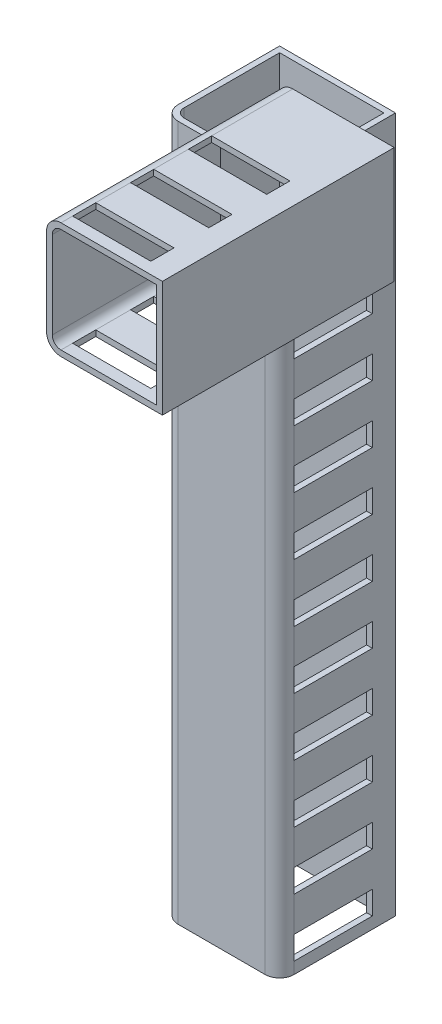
SolidWorks part; units mm, degrees
ref_plane "Front Plane" through (0, 0, 0) normal (0, 0, 1) x (1, 0, 0)
ref_plane "Top Plane" through (0, 0, 0) normal (0, 1, 0) x (1, 0, 0)
ref_plane "Right Plane" through (0, 0, 0) normal (1, 0, 0) x (0, 0, -1)
sketch "Sketch1" plane through (0, 0, 0) normal (0, 0, 1) x (1, 0, 0)
  line L1 (-70.7206, 279.4357) -> (-19.9206, 279.4357)
  line L2 (-70.7206, 279.4357) -> (-70.7206, -25.3643)
  line L3 (-70.7206, -25.3643) -> (-19.9206, -25.3643)
  line L4 (-19.9206, 279.4357) -> (-19.9206, -25.3643)
  dimension "D1" = 304.8
  dimension "D2" = 50.8
  dimension "D3" = 19.9206
  dimension "D4" = 279.4357
extrude "Boss-Extrude1" add sketch "Sketch1" along normal blind 50.8
ref_plane "Plane1" through (-0.1086, 0, 0) normal (1, 0, 0) x (0, 0, -1)
sketch "Sketch2" plane through (-0.1086, 0, 0) normal (-1, 0, 0) x (0, 0, 1)
  line L0 (3.0697, 113.4364) -> (3.0697, 138.8364) construction
  line L1 (121.969, 286.4007) -> (20.369, 286.4007)
  line L2 (121.969, 286.4007) -> (121.969, 235.6007)
  line L3 (121.969, 235.6007) -> (20.369, 235.6007)
  line L4 (20.369, 286.4007) -> (20.369, 235.6007)
  dimension "D1" = 50.8
  dimension "D2" = 101.6
  dimension "D3" = 17.2993
  dimension "D4" = 235.6007
extrude "Boss-Extrude2" add sketch "Sketch2" along normal blind 50.8
fillet "Fillet1" radius 6.35 4 edges at (-19.9206, 105.1182, 50.8) (-70.7206, 127.0357, 50.8) (-50.9086, 235.6007, 86.3845) (-50.9086, 286.4007, 71.169)
shell "Shell1" thickness 2.54
sketch "Sketch3" plane through (-70.7206, 0, 0) normal (-1, 0, 0) x (0, 0, 1)
  line L0 (0, 279.4357) -> (0, -25.3643) construction
  line L1 (10.16, -10.1243) -> (44.45, -10.1243)
  line L2 (10.16, -10.1243) -> (10.16, -20.2843)
  line L3 (10.16, -20.2843) -> (44.45, -20.2843)
  line L4 (44.45, -10.1243) -> (44.45, -20.2843)
  line L5 (44.45, -25.3643) -> (0, -25.3643) construction
  dimension "D1" = 10.16
  dimension "D2" = 34.29
  dimension "D3" = 10.16
  dimension "D4" = 5.08
extrude "Cut-Extrude1" cut sketch "Sketch3" against normal through all both and the other way through all
pattern_linear "LPattern1" count 10 spacing 25.4 along (0, 1, 0) of "Cut-Extrude1"
sketch "Sketch4" plane through (0, 235.6007, 0) normal (0, -1, 0) x (1, 0, 0)
  line L0 (-44.5586, 121.969) -> (-0.1086, 121.969) construction
  line L1 (-44.5586, 106.729) -> (-10.2686, 106.729)
  line L2 (-44.5586, 106.729) -> (-44.5586, 116.889)
  line L3 (-44.5586, 116.889) -> (-10.2686, 116.889)
  line L4 (-10.2686, 106.729) -> (-10.2686, 116.889)
  line L5 (-0.1086, 20.369) -> (-0.1086, 121.969) construction
  dimension "D1" = 10.16
  dimension "D2" = 34.29
  dimension "D3" = 5.08
  dimension "D4" = 10.16
extrude "Cut-Extrude2" cut sketch "Sketch4" against normal through all
pattern_linear "LPattern2" count 3 spacing 25.4 along (0, 0, -1) of "Cut-Extrude2"
